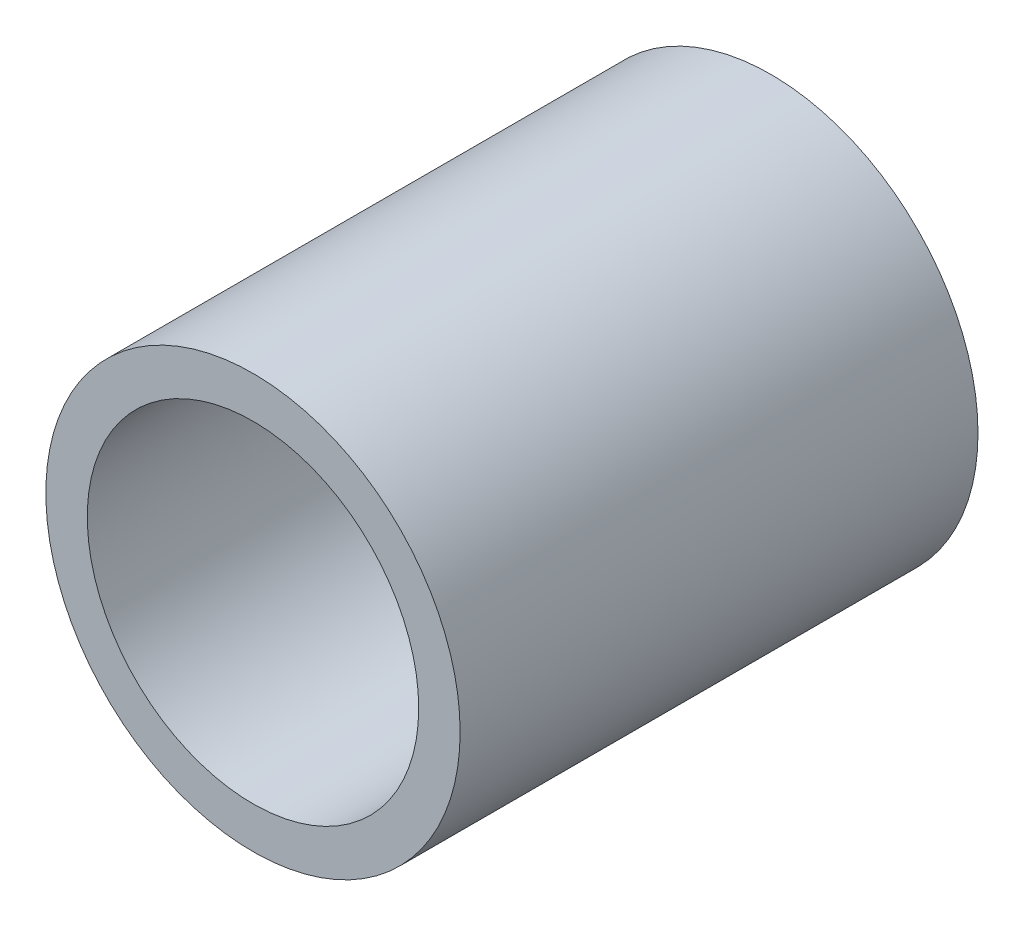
SolidWorks part; units mm, degrees
ref_plane "Спереди" through (0, 0, 0) normal (0, 0, 1) x (1, 0, 0)
ref_plane "Сверху" through (0, 0, 0) normal (0, 1, 0) x (1, 0, 0)
ref_plane "Справа" through (0, 0, 0) normal (1, 0, 0) x (0, 0, -1)
sketch "Эскиз1" plane through (0, 0, 0) normal (0, 0, 1) x (1, 0, 0)
  circle A0 centre (0, 0) radius 4
  circle A1 centre (0, 0) radius 5
  dimension "D1" = 8
  dimension "D2" = 10
extrude "Бобышка-Вытянуть1" add sketch "Эскиз1" along normal blind 12.5
